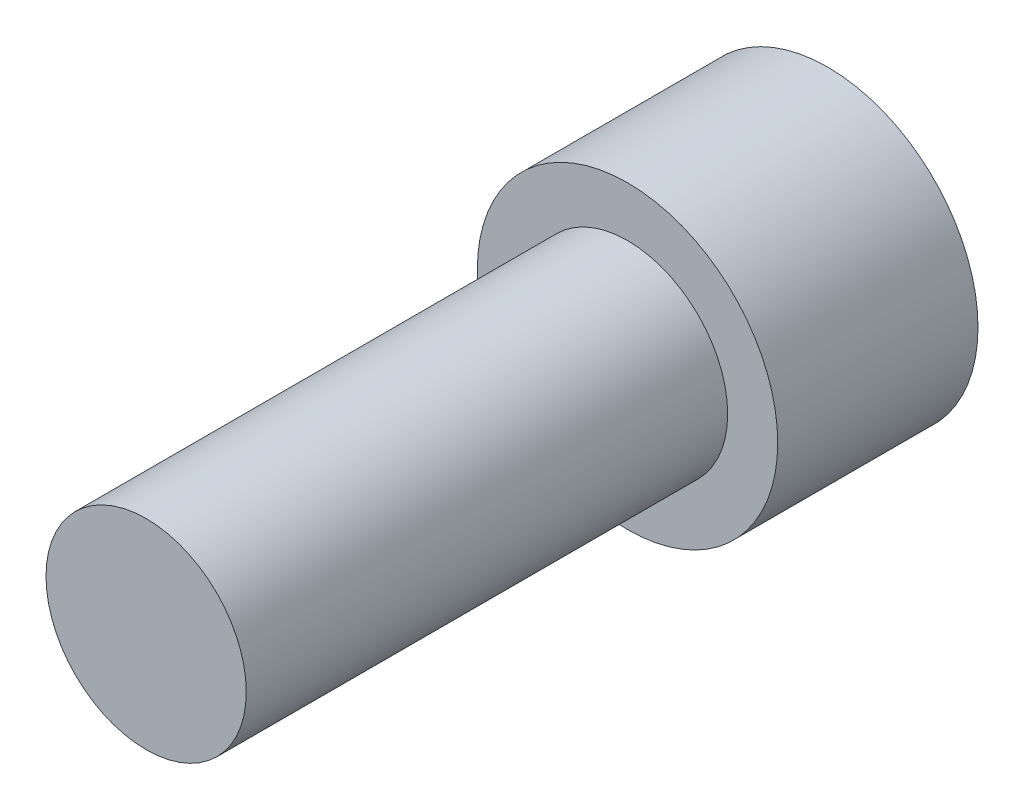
SolidWorks part; units mm, degrees
ref_plane "Front Plane" through (0, 0, 0) normal (0, 0, 1) x (1, 0, 0)
ref_plane "Top Plane" through (0, 0, 0) normal (0, 1, 0) x (1, 0, 0)
ref_plane "Right Plane" through (0, 0, 0) normal (1, 0, 0) x (0, 0, -1)
sketch "Sketch6" plane through (0, 0, 0) normal (1, 0, 0) x (0, 0, -1)
  line L0 (-19.05, 0) -> (22.525, 0) construction
  line L1 (6.538, 0) -> (-6.538, 0) construction
  line L2 (-19.05, 0) -> (-19.05, -3.9624)
  line L3 (-19.05, -3.9624) -> (0, -3.9624)
  line L4 (0, 6.538) -> (0, -6.538) construction
  line L5 (0, -3.9624) -> (0, -5.9436)
  line L6 (0, -5.9436) -> (7.9248, -5.9436)
  line L7 (7.9248, -5.9436) -> (7.9248, 0)
  line L8 (7.9248, 0) -> (-19.05, 0)
  dimension "L" = 19.05
  dimension "H" = 7.9248
  dimension "A" = 11.8872
  dimension "D" = 7.9248
revolve "Revolve1" add sketch "Sketch6" angle 360 about L0
sketch "Sketch7" plane through (0, 0, -7.9248) normal (0, 0, -1) x (-1, 0, 0)
  line L2 (-3.175, 1.8331) -> (-3.175, -1.8331)
  line L4 (-3.175, -1.8331) -> (0, -3.6662)
  line L5 (0, -3.6662) -> (3.175, -1.8331)
  line L6 (3.175, -1.8331) -> (3.175, 1.8331)
  line L7 (3.175, 1.8331) -> (0, 3.6662)
  line L8 (0, 3.6662) -> (-3.175, 1.8331)
  circle A0 centre (0, 0) radius 3.175 construction
  dimension "J" = 6.35
extrude "HEX" cut sketch "Sketch7" against normal blind 4.826
